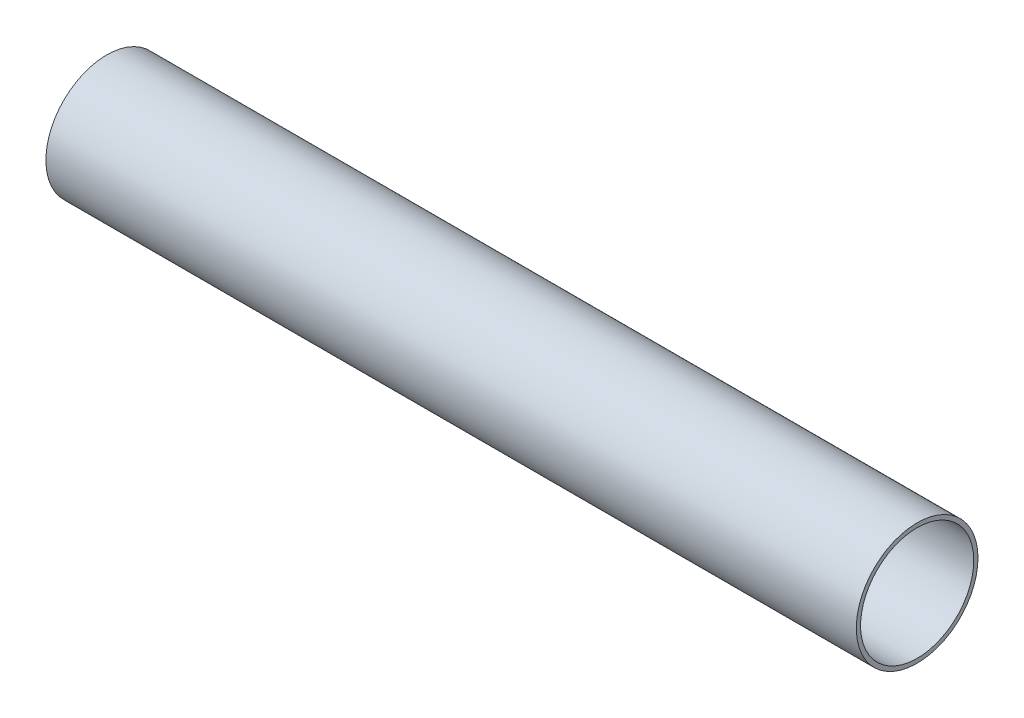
SolidWorks part; units mm, degrees
ref_plane "Front Plane" through (0, 0, 0) normal (0, 0, 1) x (1, 0, 0)
ref_plane "Top Plane" through (0, 0, 0) normal (0, 1, 0) x (1, 0, 0)
ref_plane "Right Plane" through (0, 0, 0) normal (1, 0, 0) x (0, 0, -1)
sketch "Sketch1" plane through (0, 0, 0) normal (1, 0, 0) x (0, 0, -1)
  circle A0 centre (0, 0) radius 29.083
  circle A1 centre (0, 0) radius 27.051
  dimension "D1" = 58.166
  dimension "D2" = 54.102
extrude "Extrude1" add sketch "Sketch1" along normal blind 387.35
